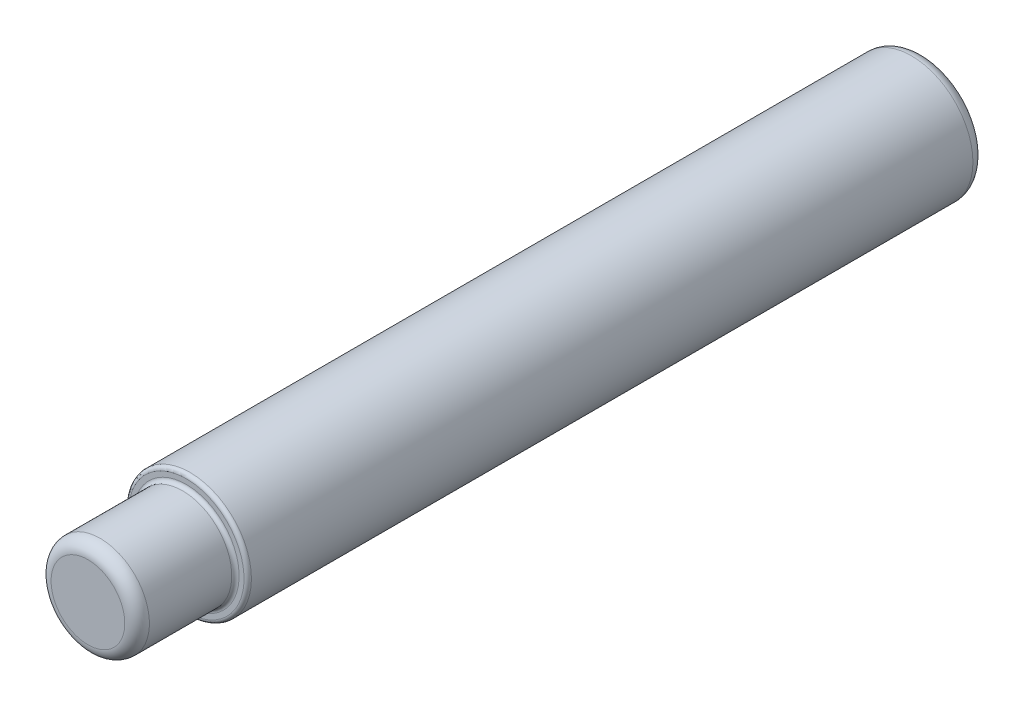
SolidWorks part; units mm, degrees
ref_plane "Спереди" through (0, 0, 0) normal (0, 0, 1) x (1, 0, 0)
ref_plane "Сверху" through (0, 0, 0) normal (0, 1, 0) x (1, 0, 0)
ref_plane "Справа" through (0, 0, 0) normal (1, 0, 0) x (0, 0, -1)
sketch "Эскиз1" plane through (0, 0, 0) normal (1, 0, 0) x (0, 0, -1)
  line L0 (-17, 0) -> (17, 0)
  line L1 (17, 0) -> (17, 2.5)
  line L2 (17, 2.5) -> (-13, 2.5)
  line L3 (-13, 2.5) -> (-13, 2)
  line L4 (-13, 2) -> (-17, 2)
  line L5 (-17, 2) -> (-17, 0)
  dimension "D1" = 4
  dimension "D2" = 30
  dimension "D3" = 2
  dimension "D4" = 2.5
revolve "Повернуть1" add sketch "Эскиз1" angle 360 about L0
fillet "Скругление1" radius 0.5 2 edges at (2, 0, 17) (2.5, 0, -17)
fillet "Скругление2" radius 0.15 2 edges at (2.5, 0, 13) (2, 0, 13)
